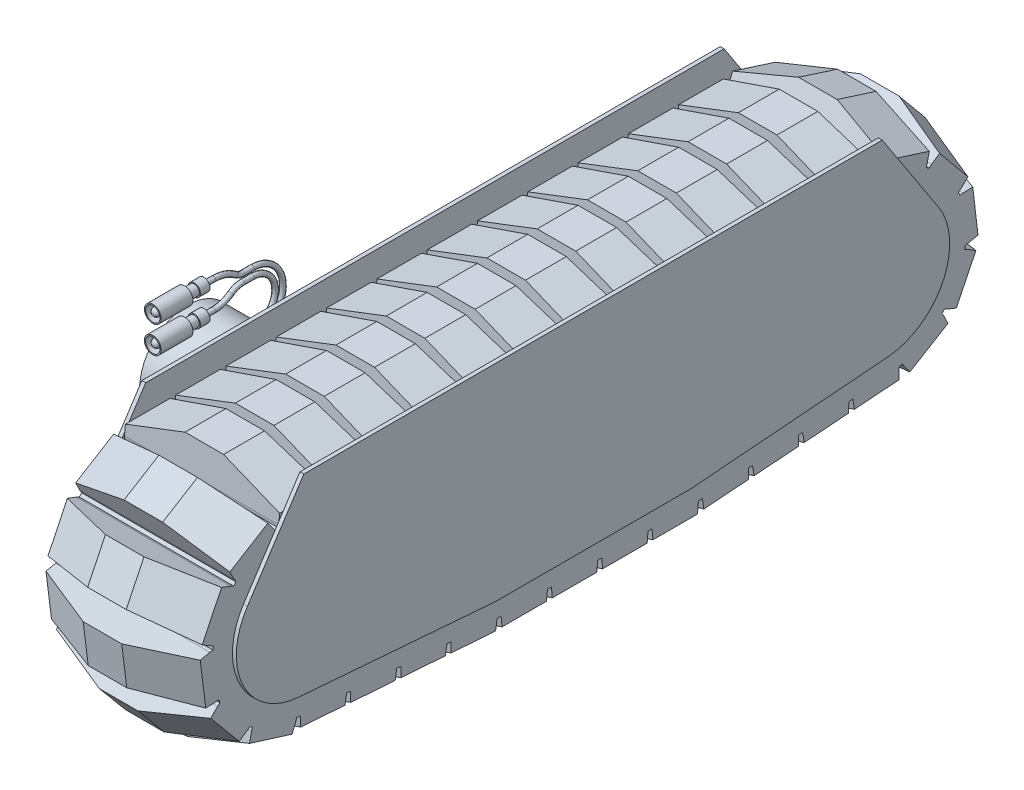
SolidWorks part; units mm, degrees
other "<___CuGoV3>-<<CuGoV3>-<_____1>[1]>"
other "<___CuGoV3>-<<CuGoV3>-<_____2>[1]>"
other "<___CuGoV3>-<<CuGoV3>-<___ - _____o__4>[1]>"
ref_plane "正面" through (0, 0, 0) normal (0, 0, 1) x (1, 0, 0)
ref_plane "平面" through (0, 0, 0) normal (0, 1, 0) x (1, 0, 0)
ref_plane "右側面" through (0, 0, 0) normal (1, 0, 0) x (0, 0, -1)
mirrored part "___CuGoV3_ﾐﾗｰ ｺﾋﾟｰ"
